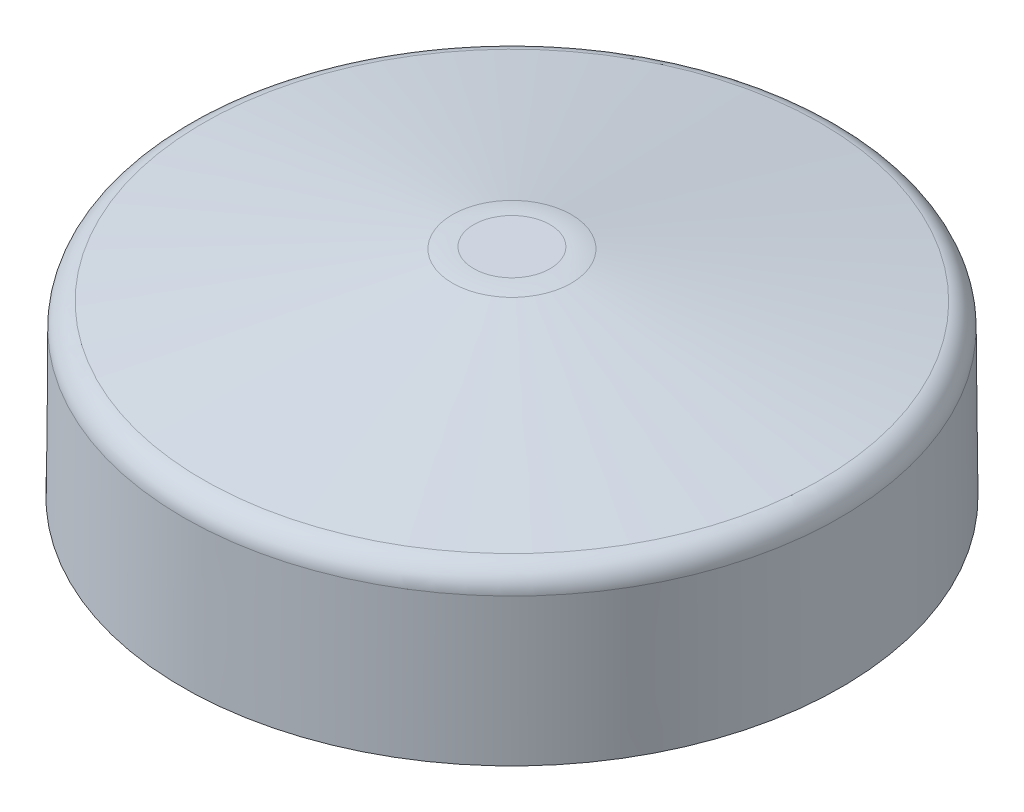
SolidWorks part; units mm, degrees
ref_plane "X" through (0, 0, 0) normal (0, 0, 1) x (1, 0, 0)
ref_plane "Y" through (0, 0, 0) normal (0, 1, 0) x (1, 0, 0)
ref_plane "Z" through (0, 0, 0) normal (1, 0, 0) x (0, 0, -1)
sketch "Esquisse1" plane through (0, 0, 0) normal (0, 0, 1) x (1, 0, 0)
  line L0 (0, 0) -> (0, 105.9533) construction
  line L1 (25, 0) -> (24.8985, 11.6357)
  line L2 (24.8985, 11.6357) -> (4.1289, 15.4233)
  line L3 (0, 18.3) -> (0, 15.3)
  line L4 (25, 0) -> (27.8301, 0)
  line L5 (27.8301, 0) -> (27.7079, 14)
  line L6 (27.7079, 14) -> (4.1289, 18.3)
  line L7 (4.1289, 18.3) -> (0, 18.3)
  line L8 (4.1289, 15.4233) -> (3.725, 0)
  line L9 (3.725, 0) -> (1.725, 0)
  line L10 (1.725, 0) -> (1.725, 15.3)
  line L11 (1.725, 15.3) -> (0, 15.3)
  dimension "D1" = 14
  dimension "D2" = 18.3
  dimension "D3" = 3.45
  dimension "D4" = 3
  dimension "D5" = 2
  dimension "D6" = 1.5
  dimension "D7" = 0.5
  dimension "D8" = 2.83
  dimension "D9" = 2.83
  dimension "D10" = 50
revolve "Base-Révolution" add sketch "Esquisse1" angle 360 about L0
fillet "Congé1" radius 2
fillet "Congé2" radius 1
sketch "Esquisse2" plane through (0, 0, 0) normal (0, 0, 1) x (1, 0, 0)
  line L0 (27.25, -0.2) -> (27.25, 3.8)
  line L1 (27.25, 3.8) -> (25, 3.8)
  line L2 (25, -10.4397) -> (25, 17.1065) construction
  line L3 (27.25, -0.2) -> (25, -0.2)
  line L5 (-27.8301, 0) -> (27.8301, 0) construction
  line L6 (25, 3.8) -> (25, -0.2)
  dimension "D1" = 4
  dimension "D2" = 4.5
  dimension "D3" = 0.2
  dimension "D4" = 25
revolve "Enlèvement de matière-Révolution1" cut sketch "Esquisse2" angle 360 about L2
draft "Dépouille3" type of draft neutral plane draft angle 0.25 faces to draft 1 parameters "D1"=0.25
fillet "Congé3" radius 0.5
draft "Dépouille4" type of draft neutral plane draft angle 0.25 faces to draft 1 parameters "D1"=0.25
fillet "Congé4" radius 10
